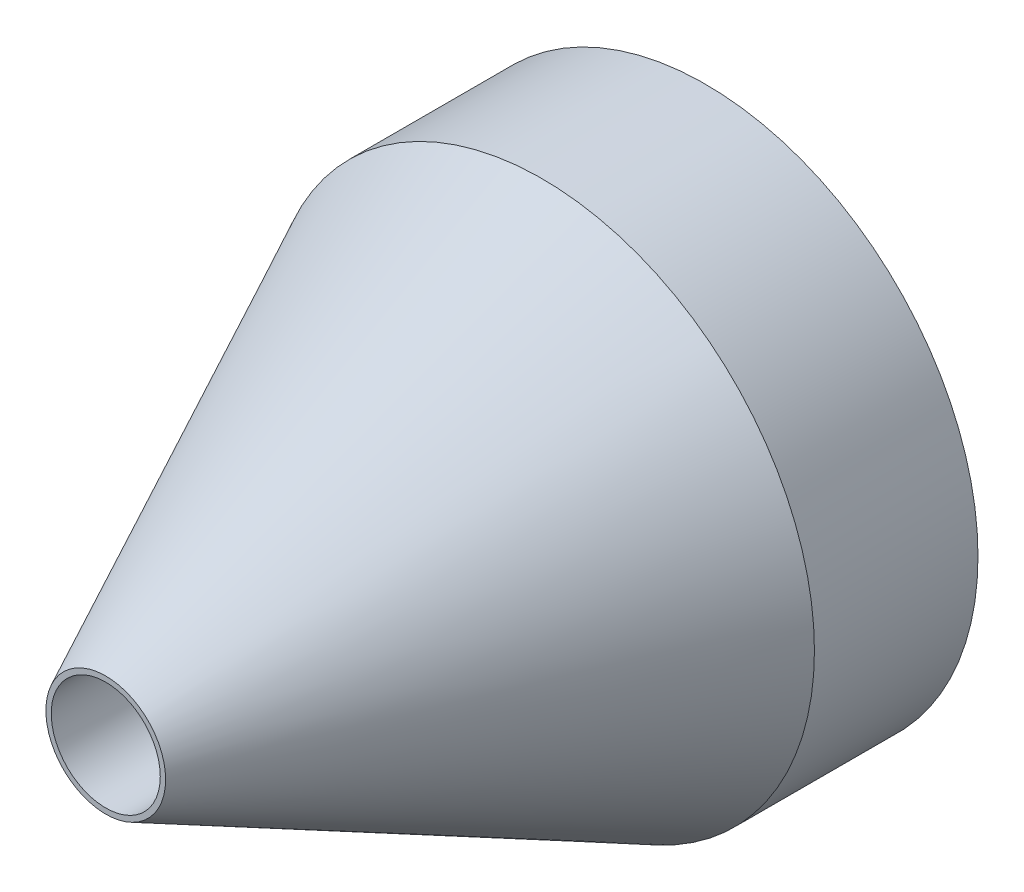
SolidWorks part; units mm, degrees
ref_plane "Plan de face" through (0, 0, 0) normal (0, 0, 1) x (1, 0, 0)
ref_plane "Plan de dessus" through (0, 0, 0) normal (0, 1, 0) x (1, 0, 0)
ref_plane "Plan de droite" through (0, 0, 0) normal (1, 0, 0) x (0, 0, -1)
sketch "Esquisse1" plane through (0, 0, 0) normal (0, 0, 1) x (1, 0, 0)
  circle A0 centre (0, 0) radius 25
  dimension "D1" = 50
extrude "Boss.-Extru.1" add sketch "Esquisse1" along normal blind 15
sketch "Esquisse2" plane through (0, 0, 15) normal (0, 0, 1) x (1, 0, 0)
  circle A0 centre (0, 0) radius 25
extrude "Boss.-Extru.2" add sketch "Esquisse2" along normal blind 40 draft 26
sketch "Esquisse3" plane through (0, 0, 0) normal (0, 0, -1) x (-1, 0, 0)
  circle A0 centre (0, 0) radius 19.75
  dimension "D1" = 39.5
extrude "Enlèv. mat.-Extru.1" cut sketch "Esquisse3" against normal blind 15
sketch "Esquisse4" plane through (0, 0, 15) normal (0, 0, -1) x (-1, 0, 0)
  circle A0 centre (0, 0) radius 20.15
  dimension "D1" = 40.3
extrude "Enlèv. mat.-Extru.2" cut sketch "Esquisse4" against normal blind 45 draft 25
sketch "Esquisse5" plane through (0, 0, 55) normal (0, 0, 1) x (1, 0, 0)
  circle A0 centre (0, 0) radius 5
  dimension "D1" = 10
extrude "Enlèv. mat.-Extru.3" cut sketch "Esquisse5" against normal blind 45
chamfer "Chanfrein1" distance 1.5 angle 45 1 edges at (-19.75, 0, 0)
thread "Filetage1" pitch 2.1167 start angle 0, offset 2, length 0, pitch 2.31, diameter 40.3
ref_plane "Plan2" through (20.15, 0, -2) normal (0, -1, 0) x (1, 0, 0)
sketch "Profil de filetage2" plane through (20.15, 0, -2) normal (0, -1, 0) x (1, 0, 0)
  line L0 (0, 0) -> (0, 2.1167) construction
  line L1 (0, 0) -> (1.1457, 0.6615)
  line L2 (1.1457, 0.6615) -> (1.1457, 0.926)
  line L3 (1.1457, 0.926) -> (0, 1.5875)
  line L4 (1.1457, 0.7937) -> (0, 0.7937) construction
  line L11 (0, 0) -> (0, 1.5875)
  point P2 (0, 0)
  dimension "Pitch" = 2.1167
  dimension "Profile_Angle" = 60
  dimension "Profile_Land" = 0.2646
  dimension "Profile_Height" = 1.1457
equation "\"çà\"=0"
